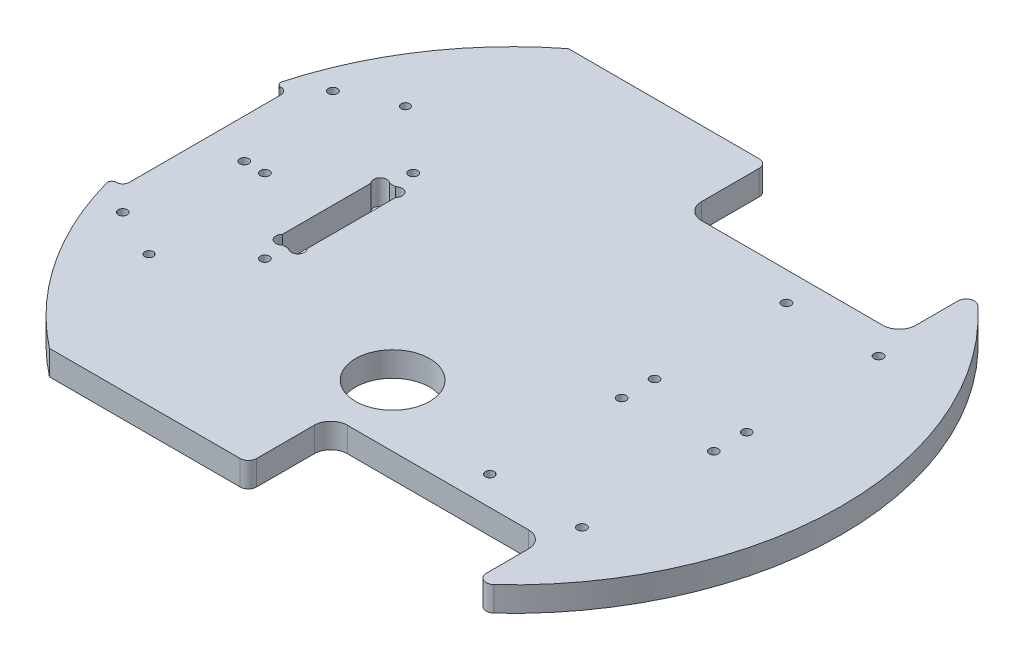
SolidWorks part; units mm, degrees
ref_plane "Plan de face" through (0, 0, 0) normal (0, 0, 1) x (1, 0, 0)
ref_plane "Plan de dessus" through (0, 0, 0) normal (0, 1, 0) x (1, 0, 0)
ref_plane "Plan de droite" through (0, 0, 0) normal (1, 0, 0) x (0, 0, -1)
sketch "Esquisse1" plane through (0, 0, 0) normal (0, 1, 0) x (1, 0, 0)
  line L0 (-111.0793, 0) -> (144.6389, 0) construction
  line L1 (0, -11.2854) -> (0, 92.4278) construction
  line L2 (-72, -36.9976) -> (-72, -13.0229) construction
  line L3 (-89.5, -93.4535) -> (-89.5, 39.6426) construction
  line L4 (-104.3932, 20) -> (-78.95, 20) construction
  line L5 (-84, -84.8277) -> (-84, 31.1) construction
  line L6 (4, 20.8682) -> (4, -58.695) construction
  line L8 (49.5, 20.8682) -> (49.5, -38.6395) construction
  line L9 (15.6, 11.6292) -> (15.6, -28.2202) construction
  line L10 (10.5621, -4) -> (39.9669, -4) construction
  line L11 (37.9, 11.6292) -> (37.9, -28.2202) construction
  line L12 (56.6736, -20) -> (46.2603, -20) construction
  line L13 (44.1725, -43) -> (-34.676, -43) construction
  line L14 (36, -93.4535) -> (36, -41.3056) construction
  line L15 (-16, -93.4535) -> (-16, -25.5) construction
  line L16 (-111.0793, -63) -> (69.2583, -63) construction
  line L17 (-64.3052, -63) -> (-18, -63)
  line L18 (-78.95, -25.5) -> (-104.3932, -25.5) construction
  line L19 (-16, -61) -> (-16, -47)
  line L20 (36, -57.2276) -> (36, -47)
  line L21 (-12, -43) -> (32, -43)
  line L22 (-91.1577, 20) -> (-91.1, 20)
  line L23 (36, 57.2276) -> (36, 47)
  line L24 (-12, 43) -> (32, 43)
  line L25 (-16, 61) -> (-16, 47)
  line L26 (-64.3052, 63) -> (-18, 63)
  line L27 (-89.5, 18.4) -> (-89.5, -18.4)
  line L28 (-91.1577, -20) -> (-91.1, -20)
  line L29 (-111.0793, -31.1) -> (-66.4942, -31.1) construction
  line L30 (-57, -58.695) -> (-57, 27.3313) construction
  line L31 (-39.625, 18) -> (-59.7757, 18) construction
  line L32 (-45.846, 13) -> (-63.099, 13) construction
  line L33 (-54, 24.6265) -> (-54, -11.2854) construction
  line L34 (-80, -11.2854) -> (-80, 7.7047) construction
  line L35 (-95, 17.369) -> (-95, -4) construction
  line L36 (-54, 13) -> (-68.1357, -1.1357) construction
  line L37 (-54, 10.7373) -> (-54, -10.7373)
  line L38 (-60, 10.7373) -> (-60, -10.7373)
  line L39 (-57.7373, -13) -> (-56.2627, -13)
  line L40 (-57.7373, 13) -> (-56.2627, 13)
  line L41 (-34.676, -28) -> (-13.1775, -28) construction
  line L46 (-75, 17.369) -> (-75, -11.2854) construction
  line L47 (10, 4) -> (10, -84.8277) construction
  line L48 (43.5, 11.6292) -> (43.5, -20) construction
  arc A0 (39.359, -58.695) -> (39.359, 58.695) centre (-15, 0) ccw
  circle A1 centre (15.6, -4) radius 1.1
  circle A2 centre (37.959, -4) radius 1.1
  circle A3 centre (37.959, -36) radius 1.1
  circle A4 centre (15.6, -36) radius 1.1
  circle A5 centre (37.959, 4) radius 1.1
  circle A6 centre (37.959, 36) radius 1.1
  circle A7 centre (15.6, 36) radius 1.1
  circle A8 centre (15.6, 4) radius 1.1
  arc A9 (36, 47) -> (32, 43) centre (32, 47) cw
  arc A10 (-64.3052, 63) -> (-92.1218, 21.2658) centre (-15, 0) ccw
  arc A11 (-12, 43) -> (-16, 47) centre (-12, 47) cw
  arc A12 (32, -43) -> (36, -47) centre (32, -47) cw
  arc A13 (-16, -47) -> (-12, -43) centre (-12, -47) cw
  circle A14 centre (-84, 25.5) radius 1.1
  circle A15 centre (-84, -25.5) radius 1.1
  circle A16 centre (-72, -31.1) radius 1.05
  circle A17 centre (-72, 31.1) radius 1.05
  circle A18 centre (-80, 0) radius 1.1
  arc A19 (-92.1218, -21.2658) -> (-64.3052, -63) centre (-15, 0) ccw
  arc A20 (-91.1, -20) -> (-89.5, -18.4) centre (-91.1, -18.4) ccw
  arc A21 (-91.1, 20) -> (-89.5, 18.4) centre (-91.1, 18.4) cw
  circle A22 centre (-80, 0) radius 9 construction
  arc A23 (-91.1577, -20) -> (-92.1218, -21.2658) centre (-91.1577, -21) ccw
  arc A24 (-91.1577, 20) -> (-92.1218, 21.2658) centre (-91.1577, 21) cw
  circle A25 centre (-57, 18) radius 1.1
  arc A26 (-54, 10.7373) -> (-56.2627, 13) centre (-55.1314, 11.8686) ccw
  circle A27 centre (-15, 0) radius 79 construction
  circle A28 centre (-75, 0) radius 1.1
  arc A29 (36, -57.2276) -> (39.359, -58.695) centre (38, -57.2276) ccw
  arc A30 (-18, -63) -> (-16, -61) centre (-18, -61) ccw
  arc A31 (39.359, 58.695) -> (36, 57.2276) centre (38, 57.2276) ccw
  arc A32 (-16, 61) -> (-18, 63) centre (-18, 61) ccw
  arc A33 (-54, -10.7373) -> (-56.2627, -13) centre (-55.1314, -11.8686) cw
  circle A34 centre (-57, -18) radius 1.1
  arc A35 (-60, 10.7373) -> (-57.7373, 13) centre (-58.8686, 11.8686) cw
  arc A36 (-60, -10.7373) -> (-57.7373, -13) centre (-58.8686, -11.8686) ccw
  circle A37 centre (-16, -28) radius 9
  point P58 (36, 43)
  point P66 (-16, 43)
  point P69 (36, -61.636)
  point P71 (36, -43)
  point P74 (-16, -43)
  point P94 (-89.5, -20)
  point P102 (-89.5, 20)
  point P105 (-92.4597, -20)
  point P109 (-92.4597, 20)
  point P150 (-16, -63)
  point P155 (-16, 63)
  dimension "D8" = 20
  dimension "D9" = 4
  dimension "D13" = 52
  dimension "D12" = 26
  dimension "D16" = 4
  dimension "D21" = 25.5
  dimension "D22" = 1.6
  dimension "D23" = 15
  dimension "D24" = 1
  dimension "D30" = 15
  dimension "D34" = 20
  dimension "D35" = 6
  dimension "D36" = 2
  dimension "D17" = 20
  dimension "D4" = 23
  dimension "D6" = 6
  dimension "D7" = 45.5
  dimension "D10" = 11.6
  dimension "D11" = 22.3
  dimension "D15" = 20
  dimension "D18" = 73.5
  dimension "D19" = 31.1
  dimension "D20" = 68
  dimension "D25" = 41
  dimension "D26" = 3
  dimension "D27" = 18
  dimension "D28" = 13
  dimension "D29" = 45
extrude "Extrusion1" add sketch "Esquisse1" along normal blind 6
